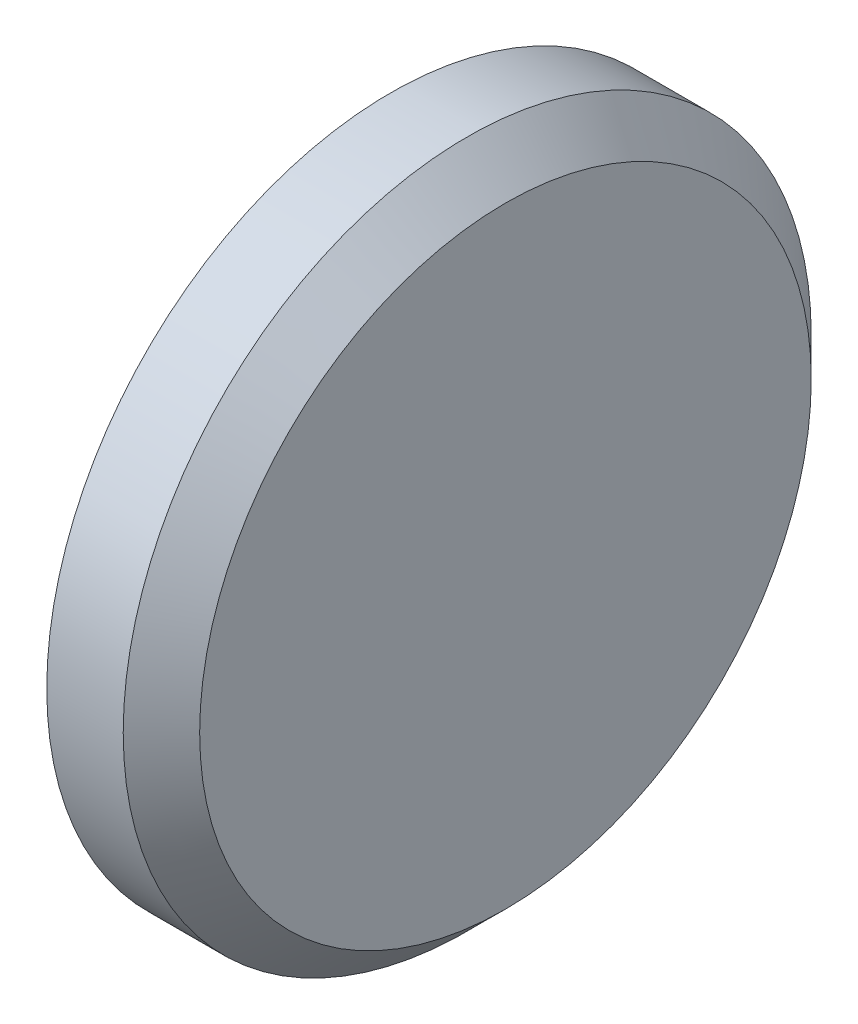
SolidWorks part; units mm, degrees
ref_plane "Front Plane" through (0, 0, 0) normal (0, 0, 1) x (1, 0, 0)
ref_plane "Top Plane" through (0, 0, 0) normal (0, 1, 0) x (1, 0, 0)
ref_plane "Right Plane" through (0, 0, 0) normal (1, 0, 0) x (0, 0, -1)
sketch "Sketch1" plane through (0, 0, 0) normal (1, 0, 0) x (0, 0, -1)
  circle A0 centre (0, 0) radius 9
  dimension "D1" = 18
extrude "Boss-Extrude1" add sketch "Sketch1" along normal blind 3
chamfer "Chamfer1" distance 1 angle 45 1 edges at (3, 0, -9)
